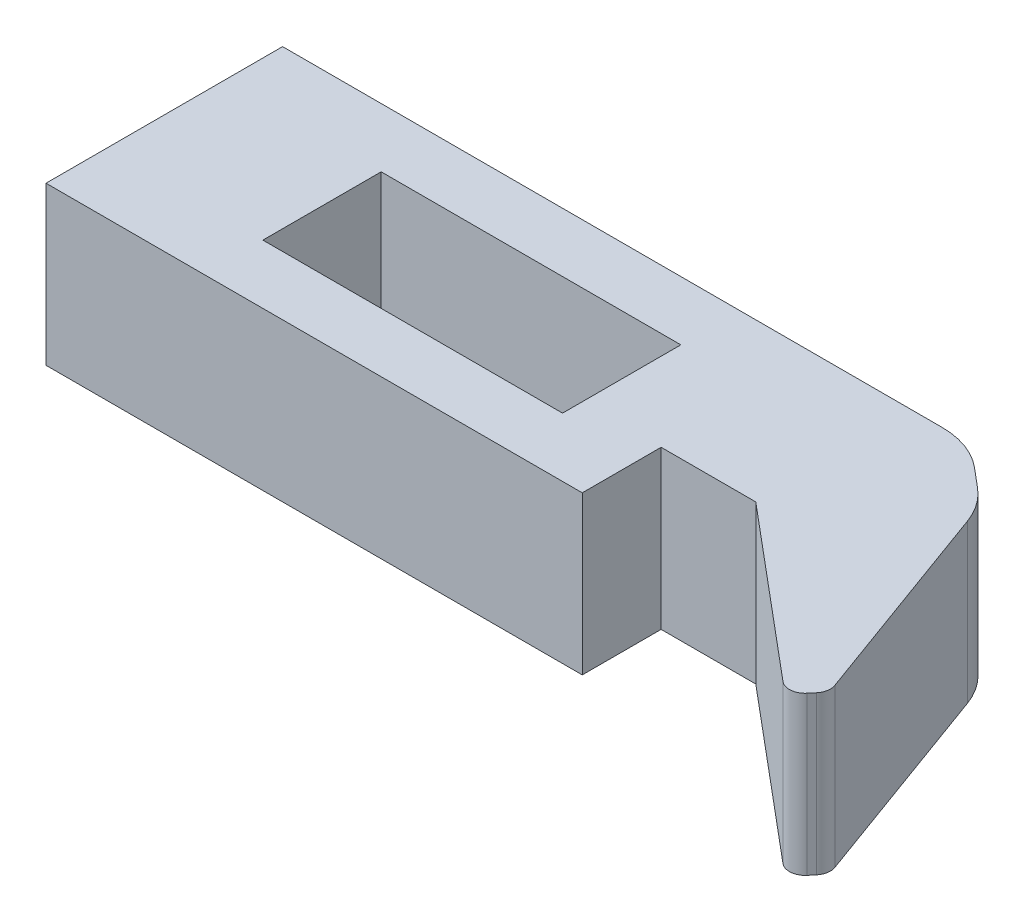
SolidWorks part; units mm, degrees
ref_plane "前视基准面" through (0, 0, 0) normal (0, 0, 1) x (1, 0, 0)
ref_plane "上视基准面" through (0, 0, 0) normal (0, 1, 0) x (1, 0, 0)
ref_plane "右视基准面" through (0, 0, 0) normal (1, 0, 0) x (0, 0, -1)
other "Configuration Table"
sketch "草图1" plane through (0, 0, 0) normal (0, 1, 0) x (1, 0, 0)
  line L0 (3.9, -0.5) -> (4.1, -0.5)
  line L1 (-1.9, -0.75) -> (1.9, -0.75)
  line L2 (-1.9, -0.75) -> (-1.9, 0.75)
  line L3 (-1.9, 0.75) -> (1.9, 0.75)
  line L4 (1.9, -0.75) -> (1.9, 0.75)
  line L5 (-1.9, -0.75) -> (1.9, 0.75) construction
  line L6 (-1.9, 0.75) -> (1.9, -0.75) construction
  line L7 (-3.9, -1.5) -> (3.9, -1.5)
  line L8 (-3.9, -1.5) -> (-3.9, 1.5)
  line L9 (-3.9, 1.5) -> (3.9, 1.5)
  line L10 (3.9, -1.5) -> (3.9, 1.5) construction
  line L11 (-3.9, -1.5) -> (3.9, 1.5) construction
  line L12 (-3.9, 1.5) -> (3.9, -1.5) construction
  line L13 (4.1, -0.5) -> (6.3981, -2.4284)
  line L18 (3.9, 1.5) -> (4.8279, 1.5)
  line L19 (4.8279, 1.5) -> (7.6837, -0.8963)
  line L20 (7.6837, -0.8963) -> (6.3981, -2.4284)
  line L21 (3.9, -0.5) -> (3.9, -1.5)
  point P0 (0, 0)
  point P6 (0, 0)
  dimension "D1" = 3.8
  dimension "D2" = 1.5
  dimension "D3" = 2
  dimension "D4" = 3
  dimension "D5" = 2
  dimension "D6" = 2
  dimension "D7" = 90
  dimension "D8" = 140
  dimension "D9" = 0.2
  dimension "D10" = 3
extrude "凸台-拉伸1" add sketch "草图1" along normal blind 2
sketch "草图2" plane through (0, 2, 0) normal (0, 1, 0) x (1, 0, 0)
  line L0 (3.9, -1.5) -> (3.9, -0.5)
  line L1 (3.9, -0.5) -> (2.9, -0.5)
  line L2 (2.9, -0.5) -> (2.9, -1.5)
  line L3 (-3.9, -1.5) -> (3.9, -1.5) construction
  line L4 (2.9, -1.5) -> (3.9, -1.5)
  dimension "D1" = 1
extrude "切除-拉伸1" cut sketch "草图2" against normal through all
sketch "草图3" plane through (0, 2, 0) normal (0, 1, 0) x (1, 0, 0)
  line L0 (6.6552, -2.1219) -> (5.5608, 0.8851)
  line L1 (6.3981, -2.4284) -> (7.6837, -0.8963) construction
  line L2 (7.6837, -0.8963) -> (4.8279, 1.5) construction
  line L3 (5.5608, 0.8851) -> (7.6837, -0.8963)
  line L4 (7.6837, -0.8963) -> (6.6552, -2.1219)
  dimension "D1" = 30
  dimension "D2" = 1.6
extrude "切除-拉伸2" cut sketch "草图3" against normal through all
fillet "圆角4" radius 1 2 edges at (4.8279, 1, -1.5) (5.5608, 1, -0.8851)
fillet "圆角5" radius 0.2 2 edges at (6.6552, 1, 2.1219) (6.3981, 1, 2.4284)
